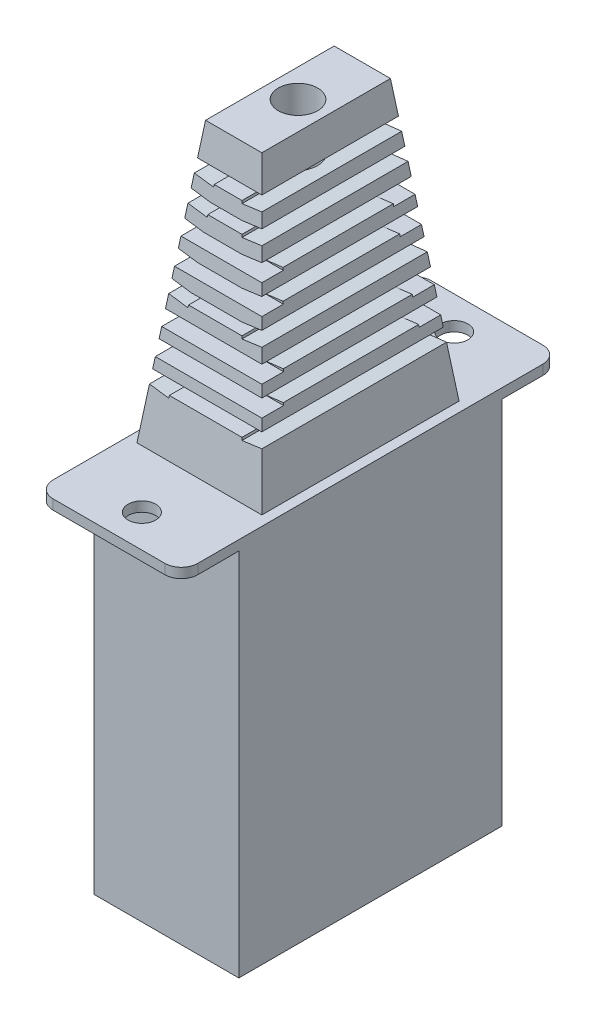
SolidWorks part; units mm, degrees
ref_plane "Plan de face" through (0, 0, 0) normal (0, 0, 1) x (1, 0, 0)
ref_plane "Plan de dessus" through (0, 0, 0) normal (0, 1, 0) x (1, 0, 0)
ref_plane "Plan de droite" through (0, 0, 0) normal (1, 0, 0) x (0, 0, -1)
sketch "Esquisse1" plane through (0, 0, 0) normal (0, 1, 0) x (1, 0, 0)
  line L0 (-22, 40) -> (22, -40) construction
  line L1 (-22, 40) -> (22, 40)
  line L2 (-22, 40) -> (-22, -40)
  line L3 (-22, -40) -> (22, -40)
  line L4 (22, 40) -> (22, -40)
  dimension "D1" = 80
  dimension "D2" = 44
extrude "Extrusion1" add sketch "Esquisse1" along normal blind 112.5
sketch "Esquisse2" plane through (0, 112.5, 0) normal (0, 1, 0) x (-1, 0, 0)
  line L0 (-22, 40) -> (-22, -40) construction
  line L1 (17, -57.5) -> (-17, -57.5)
  line L2 (22, -52.5) -> (22, 52.5)
  line L3 (17, 57.5) -> (-17, 57.5)
  line L4 (-22, -52.5) -> (-22, 52.5)
  line L5 (22, -40) -> (22, 40) construction
  line L6 (0, -57.5) -> (0, 57.5) construction
  line L7 (0, 47.5) -> (0, -47.5) construction
  circle A0 centre (0, -47.5) radius 4.2
  circle A1 centre (0, 47.5) radius 4.2
  arc A2 (-22, 52.5) -> (-17, 57.5) centre (-17, 52.5) cw
  arc A3 (-17, -57.5) -> (-22, -52.5) centre (-17, -52.5) cw
  arc A4 (22, -52.5) -> (17, -57.5) centre (17, -52.5) cw
  arc A5 (22, 52.5) -> (17, 57.5) centre (17, 52.5) ccw
  point P17 (-22, 57.5)
  point P20 (-22, -57.5)
  dimension "D2" = 5
  dimension "D3" = 8.4
  dimension "D4" = 95
  dimension "D1" = 115
extrude "Extrusion2" add sketch "Esquisse2" along normal blind 3
sketch "Esquisse3" plane through (0, 0, 0) normal (0, -1, 0) x (1, 0, 0)
  line L0 (0, 22.5) -> (0, -22.5) construction
  circle A0 centre (0, 22.5) radius 8
  circle A1 centre (0, -22.5) radius 8
  dimension "D1" = 16
  dimension "D2" = 45
extrude "Enlèv. mat.-Extru.1" cut sketch "Esquisse3" against normal blind 53
sketch "Esquisse4" plane through (0, 115.5, 0) normal (0, 1, 0) x (-1, 0, 0)
  line L0 (19, -30) -> (-19, 30) construction
  line L1 (19, -30) -> (-19, -30)
  line L2 (19, -30) -> (19, 30)
  line L3 (19, 30) -> (-19, 30)
  line L4 (-19, -30) -> (-19, 30)
  dimension "D1" = 60
  dimension "D2" = 38
extrude "Extrusion3" add sketch "Esquisse4" along normal blind 85
draft "Dépouille2" type of draft neutral plane draft angle 7 faces to draft 4 parameters "D1"=7
sketch "Esquisse7" plane through (0, 0, 40) normal (0, 0, 1) x (1, 0, 0)
  line L0 (-10.5132, 184.6193) -> (10.8351, 181.998) construction
  line L2 (-11.7671, 190.8183) -> (-3.8267, 189.8433)
  line L3 (-11.7671, 190.8183) -> (-12.2546, 186.8481)
  line L4 (-12.2546, 186.8481) -> (-4.3142, 185.8731)
  line L5 (-8.5633, 200.5) -> (-19, 115.5) construction
  line L6 (8.5633, 200.5) -> (19, 115.5) construction
  line L7 (-11.4882, 176.6789) -> (11.8399, 173.8146) construction
  line L8 (-13.4381, 160.7982) -> (13.8495, 157.4477) construction
  line L9 (0, 200.5) -> (0, 115.5) construction
  line L10 (-3.8267, 189.8433) -> (-4.3142, 185.8731)
  line L11 (-5.2892, 177.9328) -> (-4.8017, 181.903)
  line L12 (-12.7421, 182.8779) -> (-4.8017, 181.903)
  line L13 (-13.2295, 178.9077) -> (-12.7421, 182.8779)
  line L14 (-13.2295, 178.9077) -> (-5.2892, 177.9328)
  line L15 (-13.717, 174.9375) -> (-5.7766, 173.9626)
  line L16 (-13.717, 174.9375) -> (-14.2045, 170.9674)
  line L17 (-14.2045, 170.9674) -> (-6.2641, 169.9924)
  line L18 (-5.7766, 173.9626) -> (-6.2641, 169.9924)
  line L19 (-7.2391, 162.052) -> (-6.7516, 166.0222)
  line L20 (-14.692, 166.9972) -> (-6.7516, 166.0222)
  line L21 (-15.1794, 163.027) -> (-14.692, 166.9972)
  line L22 (-15.1794, 163.027) -> (-7.2391, 162.052)
  line L23 (-15.6669, 159.0568) -> (-7.7265, 158.0818)
  line L24 (-15.6669, 159.0568) -> (-16.1544, 155.0866)
  line L25 (-16.1544, 155.0866) -> (-8.214, 154.1117)
  line L26 (-7.7265, 158.0818) -> (-8.214, 154.1117)
  line L27 (-9.189, 146.1713) -> (-8.7015, 150.1415)
  line L28 (-16.6419, 151.1164) -> (-8.7015, 150.1415)
  line L29 (-17.1293, 147.1462) -> (-16.6419, 151.1164)
  line L30 (-17.1293, 147.1462) -> (-9.189, 146.1713)
  line L31 (-17.6168, 143.1761) -> (-9.6765, 142.2011)
  line L32 (-17.6168, 143.1761) -> (-18.1043, 139.2059)
  line L33 (-18.1043, 139.2059) -> (-10.1639, 138.2309)
  line L34 (-9.6765, 142.2011) -> (-10.1639, 138.2309)
  line L35 (-11.1389, 130.2906) -> (-10.6514, 134.2607)
  line L36 (-18.5918, 135.2357) -> (-10.6514, 134.2607)
  line L37 (-19.0793, 131.2655) -> (-18.5918, 135.2357)
  line L38 (-19.0793, 131.2655) -> (-11.1389, 130.2906)
  line L39 (-8.5633, 200.5) -> (8.5633, 200.5) construction
  line L40 (-19, 115.5) -> (19, 115.5) construction
  line L41 (19.0793, 131.2655) -> (11.1389, 130.2906)
  line L42 (19.0793, 131.2655) -> (18.5918, 135.2357)
  line L43 (18.5918, 135.2357) -> (10.6514, 134.2607)
  line L44 (11.1389, 130.2906) -> (10.6514, 134.2607)
  line L45 (9.6765, 142.2011) -> (10.1639, 138.2309)
  line L46 (18.1043, 139.2059) -> (10.1639, 138.2309)
  line L47 (17.6168, 143.1761) -> (18.1043, 139.2059)
  line L48 (17.6168, 143.1761) -> (9.6765, 142.2011)
  line L49 (17.1293, 147.1462) -> (9.189, 146.1713)
  line L50 (17.1293, 147.1462) -> (16.6419, 151.1164)
  line L51 (16.6419, 151.1164) -> (8.7015, 150.1415)
  line L52 (9.189, 146.1713) -> (8.7015, 150.1415)
  line L53 (7.7265, 158.0818) -> (8.214, 154.1117)
  line L54 (16.1544, 155.0866) -> (8.214, 154.1117)
  line L55 (15.6669, 159.0568) -> (16.1544, 155.0866)
  line L56 (15.6669, 159.0568) -> (7.7265, 158.0818)
  line L57 (15.1794, 163.027) -> (7.2391, 162.052)
  line L58 (15.1794, 163.027) -> (14.692, 166.9972)
  line L59 (14.692, 166.9972) -> (6.7516, 166.0222)
  line L60 (7.2391, 162.052) -> (6.7516, 166.0222)
  line L61 (5.7766, 173.9626) -> (6.2641, 169.9924)
  line L62 (14.2045, 170.9674) -> (6.2641, 169.9924)
  line L63 (13.717, 174.9375) -> (14.2045, 170.9674)
  line L64 (13.717, 174.9375) -> (5.7766, 173.9626)
  line L65 (13.2295, 178.9077) -> (5.2892, 177.9328)
  line L66 (13.2295, 178.9077) -> (12.7421, 182.8779)
  line L67 (12.7421, 182.8779) -> (4.8017, 181.903)
  line L68 (5.2892, 177.9328) -> (4.8017, 181.903)
  line L69 (3.8267, 189.8433) -> (4.3142, 185.8731)
  line L70 (12.2546, 186.8481) -> (4.3142, 185.8731)
  line L71 (11.7671, 190.8183) -> (12.2546, 186.8481)
  line L72 (11.7671, 190.8183) -> (3.8267, 189.8433)
  dimension "D1" = 8
  dimension "D2" = 6
  dimension "D3" = 4
  dimension "D4" = 2
  dimension "D5" = 16
  dimension "D6" = 8
  dimension "D7" = 2
extrude "Enlèv. mat.-Extru.3" cut sketch "Esquisse7" against normal through all
sketch "Esquisse8" plane through (22, 0, 0) normal (1, 0, 0) x (0, 0, -1)
  line L0 (-23.9549, 115.5) -> (-13.3673, 201.7294) construction
  line L1 (-27.6067, 134.992) -> (27.6067, 134.992) construction
  line L2 (-28.0942, 131.0218) -> (-21.5616, 131.0218)
  line L3 (-28.0942, 131.0218) -> (-28.0942, 134.992)
  line L4 (-28.0942, 134.992) -> (-21.5616, 134.992)
  line L5 (-52.5, 115.5) -> (52.5, 115.5) construction
  line L6 (0, 115.5) -> (0, 201.3554) construction
  line L7 (-28.0942, 131.0218) -> (-30, 115.5) construction
  line L8 (-21.5616, 131.0218) -> (-21.5616, 134.992)
  line L9 (28.0942, 131.0218) -> (-28.0942, 131.0218) construction
  line L10 (-20.782, 190.5745) -> (20.782, 190.5745) construction
  line L11 (-27.209, 138.2309) -> (-20.5867, 138.2309)
  line L12 (-27.209, 138.2309) -> (-27.209, 142.9323)
  line L13 (-27.209, 142.9323) -> (-20.5867, 142.9323)
  line L14 (-20.5867, 138.2309) -> (-20.5867, 142.9323)
  line L15 (-26.234, 146.1713) -> (-19.6117, 146.1713)
  line L16 (-26.234, 146.1713) -> (-26.234, 150.8727)
  line L17 (-26.234, 150.8727) -> (-19.6117, 150.8727)
  line L18 (-19.6117, 146.1713) -> (-19.6117, 150.8727)
  line L19 (-25.1693, 154.8429) -> (-18.7265, 154.8429)
  line L20 (-25.1693, 154.8429) -> (-25.1693, 158.0818)
  line L21 (-25.1693, 158.0818) -> (-18.7265, 158.0818)
  line L22 (-18.7265, 154.8429) -> (-18.7265, 158.0818)
  line L23 (-24.2841, 162.052) -> (-17.7516, 162.052)
  line L24 (-24.2841, 162.052) -> (-24.2841, 166.0222)
  line L25 (-24.2841, 166.0222) -> (-17.7516, 166.0222)
  line L26 (-17.7516, 162.052) -> (-17.7516, 166.0222)
  line L27 (-23.3092, 169.9924) -> (-16.7766, 169.9924)
  line L28 (-23.3092, 169.9924) -> (-23.3092, 173.9626)
  line L29 (-23.3092, 173.9626) -> (-16.7766, 173.9626)
  line L30 (-16.7766, 169.9924) -> (-16.7766, 173.9626)
  line L31 (-22.2444, 178.664) -> (-15.8017, 178.664)
  line L32 (-22.2444, 178.664) -> (-22.2444, 181.903)
  line L33 (-22.2444, 181.903) -> (-15.8017, 181.903)
  line L34 (-15.8017, 178.664) -> (-15.8017, 181.903)
  line L35 (-21.2695, 186.6044) -> (-14.7369, 186.6044)
  line L36 (-21.2695, 186.6044) -> (-21.2695, 190.5745)
  line L37 (-21.2695, 190.5745) -> (-14.7369, 190.5745)
  line L38 (-14.7369, 186.6044) -> (-14.7369, 190.5745)
  line L39 (21.2695, 186.6044) -> (-21.2695, 186.6044) construction
  line L40 (21.8467, 181.903) -> (-21.8467, 181.903) construction
  line L41 (22.2444, 178.664) -> (-22.2444, 178.664) construction
  line L42 (22.8217, 173.9626) -> (-22.8217, 173.9626) construction
  line L43 (23.3092, 169.9924) -> (-23.3092, 169.9924) construction
  line L44 (23.7967, 166.0222) -> (-23.7967, 166.0222) construction
  line L45 (24.2841, 162.052) -> (-24.2841, 162.052) construction
  line L46 (24.7716, 158.0818) -> (-24.7716, 158.0818) construction
  line L47 (25.1693, 154.8429) -> (-25.1693, 154.8429) construction
  line L48 (-25.6568, 150.8727) -> (25.6568, 150.8727) construction
  line L49 (26.234, 146.1713) -> (-26.234, 146.1713) construction
  line L50 (-26.6317, 142.9323) -> (26.6317, 142.9323) construction
  line L51 (27.209, 138.2309) -> (-27.209, 138.2309) construction
  line L52 (-27.1192, 138.9621) -> (-27.6067, 134.992) construction
  line L53 (-26.1443, 146.9025) -> (-26.6317, 142.9323) construction
  line L54 (-24.1943, 162.7832) -> (-24.6818, 158.8131) construction
  line L55 (-23.2194, 170.7236) -> (-23.7069, 166.7534) construction
  line L56 (-22.2444, 178.664) -> (-22.7319, 174.6938) construction
  line L57 (-21.2695, 186.6044) -> (-21.757, 182.6342) construction
  line L58 (14.7369, 186.6044) -> (14.7369, 190.5745)
  line L59 (21.2695, 190.5745) -> (14.7369, 190.5745)
  line L60 (21.2695, 186.6044) -> (21.2695, 190.5745)
  line L61 (21.2695, 186.6044) -> (14.7369, 186.6044)
  line L62 (15.8017, 178.664) -> (15.8017, 181.903)
  line L63 (22.2444, 181.903) -> (15.8017, 181.903)
  line L64 (22.2444, 178.664) -> (22.2444, 181.903)
  line L65 (22.2444, 178.664) -> (15.8017, 178.664)
  line L66 (16.7766, 169.9924) -> (16.7766, 173.9626)
  line L67 (23.3092, 173.9626) -> (16.7766, 173.9626)
  line L68 (23.3092, 169.9924) -> (23.3092, 173.9626)
  line L69 (23.3092, 169.9924) -> (16.7766, 169.9924)
  line L70 (17.7516, 162.052) -> (17.7516, 166.0222)
  line L71 (24.2841, 166.0222) -> (17.7516, 166.0222)
  line L72 (24.2841, 162.052) -> (24.2841, 166.0222)
  line L73 (24.2841, 162.052) -> (17.7516, 162.052)
  line L74 (18.7265, 154.8429) -> (18.7265, 158.0818)
  line L75 (25.1693, 158.0818) -> (18.7265, 158.0818)
  line L76 (25.1693, 154.8429) -> (25.1693, 158.0818)
  line L77 (25.1693, 154.8429) -> (18.7265, 154.8429)
  line L78 (19.6117, 146.1713) -> (19.6117, 150.8727)
  line L79 (26.234, 150.8727) -> (19.6117, 150.8727)
  line L80 (26.234, 146.1713) -> (26.234, 150.8727)
  line L81 (26.234, 146.1713) -> (19.6117, 146.1713)
  line L82 (20.5867, 138.2309) -> (20.5867, 142.9323)
  line L83 (27.209, 142.9323) -> (20.5867, 142.9323)
  line L84 (27.209, 138.2309) -> (27.209, 142.9323)
  line L85 (27.209, 138.2309) -> (20.5867, 138.2309)
  line L86 (21.5616, 131.0218) -> (21.5616, 134.992)
  line L87 (28.0942, 134.992) -> (21.5616, 134.992)
  line L88 (28.0942, 131.0218) -> (28.0942, 134.992)
  line L89 (28.0942, 131.0218) -> (21.5616, 131.0218)
  dimension "D1" = 6
extrude "Enlèv. mat.-Extru.4" cut sketch "Esquisse8" against normal through all
sketch "Esquisse9" plane through (0, 200.5, 0) normal (0, 1, 0) x (-1, 0, 0)
  circle A0 centre (0, 0) radius 6
  dimension "D1" = 12
extrude "Enlèv. mat.-Extru.5" cut sketch "Esquisse9" against normal blind 95
